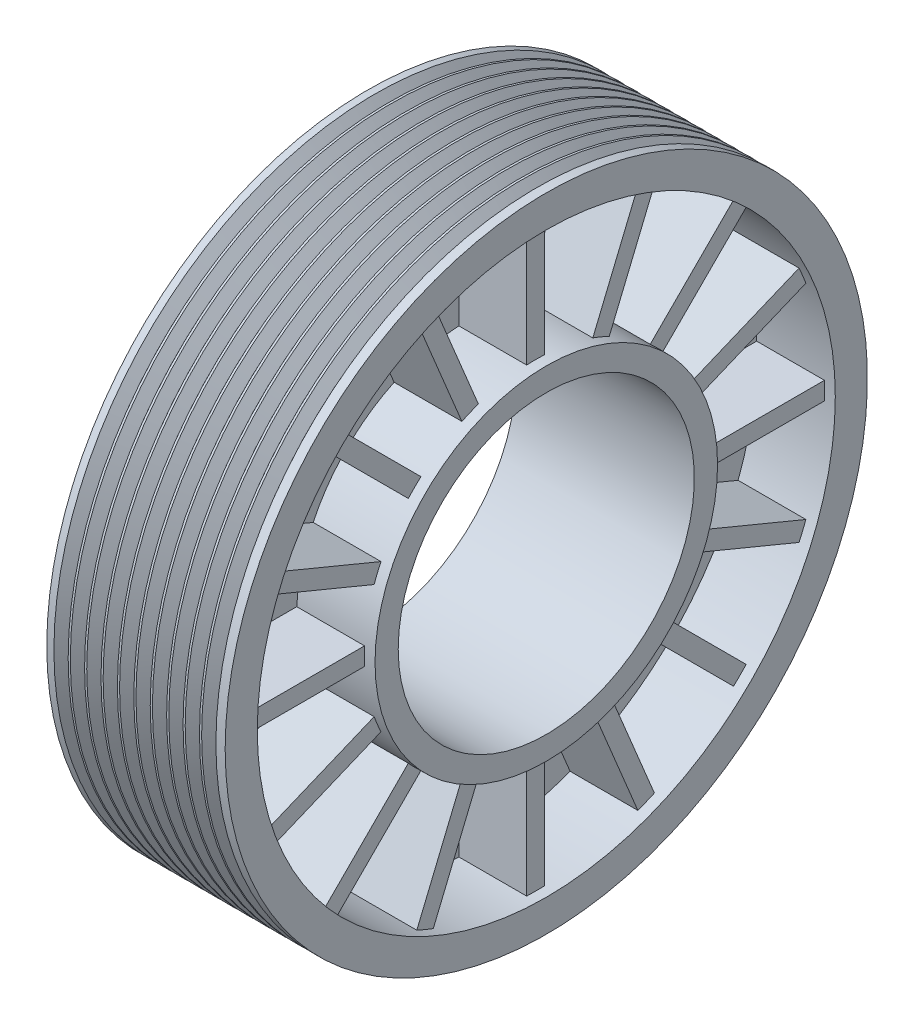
SolidWorks part; units mm, degrees
ref_plane "Plan de face" through (0, 0, 0) normal (0, 0, 1) x (1, 0, 0)
ref_plane "Plan de dessus" through (0, 0, 0) normal (0, 1, 0) x (1, 0, 0)
ref_plane "Plan de droite" through (0, 0, 0) normal (1, 0, 0) x (0, 0, -1)
sketch "Esquisse1" plane through (0, 0, 0) normal (0, 0, 1) x (1, 0, 0)
  line L0 (-30.1632, -20.75) -> (10.0103, -20.75) construction
  line L1 (12.5, 0) -> (-12.5, 0)
  line L2 (-12.5, 0) -> (-12.5, 3.25)
  line L3 (-12.5, 3.25) -> (-1.5, 3.25)
  line L4 (-1.5, 3.25) -> (-1.5, 19.75)
  line L5 (-1.5, 19.75) -> (-12.5, 19.75)
  line L6 (-12.5, 19.75) -> (-12.5, 24.25)
  line L7 (-12.5, 24.25) -> (12.5, 24.25)
  line L8 (0, 0) -> (0, 24.25) construction
  line L9 (12.5, 19.75) -> (12.5, 24.25)
  line L10 (1.5, 19.75) -> (12.5, 19.75)
  line L11 (1.5, 3.25) -> (1.5, 19.75)
  line L12 (12.5, 3.25) -> (1.5, 3.25)
  line L13 (12.5, 0) -> (12.5, 3.25)
  dimension "D1" = 25
  dimension "D2" = 11
  dimension "D3" = 48
  dimension "D4" = 81
  dimension "D5" = 90
  dimension "D6" = 41.5
revolve "Révolution1" add sketch "Esquisse1" angle 360 about L0
sketch "Esquisse2" plane through (0, 0, 0) normal (1, 0, 0) x (0, 0, -1)
  line L0 (0, 2) -> (0, 22.25)
  circle A4 centre (0, -20.75) radius 22.75 construction
  circle A5 centre (0, -20.75) radius 43 construction
  circle A6 centre (0, -20.75) radius 20.75 construction
  circle A7 centre (0, -20.75) radius 45 construction
  dimension "D1" = 2
  dimension "D2" = 2
extrude "Extru.-Mince4" add sketch "Esquisse2" along normal blind 11 and the other way blind 11 thin
pattern_circular "Répétition circulaire1" count 16 over 360 about axis through (0, -20.75, 0) along (1, 0, 0) of "Extru.-Mince4"
sketch "Esquisse3" plane through (-11, 0, 0) normal (-1, 0, 0) x (0, 0, 1)
  line L0 (0, -20.75) -> (-25.8094, 5.0594) construction
  line L1 (-16.0636, -2.9186) -> (-27.7403, 8.7581) construction
  line L2 (-17.8314, -4.6864) -> (-29.5081, 6.9903) construction
  circle A0 centre (-25.8094, 5.0594) radius 8.5
  circle A1 centre (0, -20.75) radius 45 construction
  dimension "D1" = 17
extrude "Extru.-Mince5" add sketch "Esquisse3" against normal up to surface (9.5 mm away) thin
sketch "Esquisse4" plane through (-11, 0, 0) normal (-1, 0, 0) x (0, 0, 1)
  circle A0 centre (-25.8094, 5.0594) radius 7
  arc A1 (-20.0553, 1.0731) -> (-24.0513, 11.835) centre (-25.8094, 5.0594) ccw construction
extrude "Enlèv. mat.-Extru.1" cut sketch "Esquisse4" against normal up to surface (9.5 mm away) and the other way through all
sketch "Esquisse5" plane through (0, 0, 0) normal (0, 0, 1) x (1, 0, 0)
  line L0 (-11.5, 24.25) -> (-10.5, 22.85)
  line L1 (12.5, 24.25) -> (-12.5, 24.25) construction
  line L2 (-10.5, 22.85) -> (-9.5, 24.25)
  line L4 (-10.5, 22.85) -> (-10.5, 24.35) construction
  line L5 (0, 0) -> (-16.6747, 0) construction
  line L6 (-11.5, 24.25) -> (-11.5, 24.35)
  line L7 (-11.5, 24.35) -> (-9.5, 24.35)
  line L8 (-9.5, 24.35) -> (-9.5, 24.25)
  dimension "D1" = 1
  dimension "D2" = 2
  dimension "D3" = 1.4
  dimension "D4" = 0.1
revolve "Enlèvement de matière-Révolution6" cut sketch "Esquisse5" angle 360 about axis through (-30.1632, -20.75, 0) along (1, 0, 0)
pattern_linear "Répétition linéaire2" count 10 spacing 2.3 along (1, 0, 0) of "Enlèvement de matière-Révolution6"
